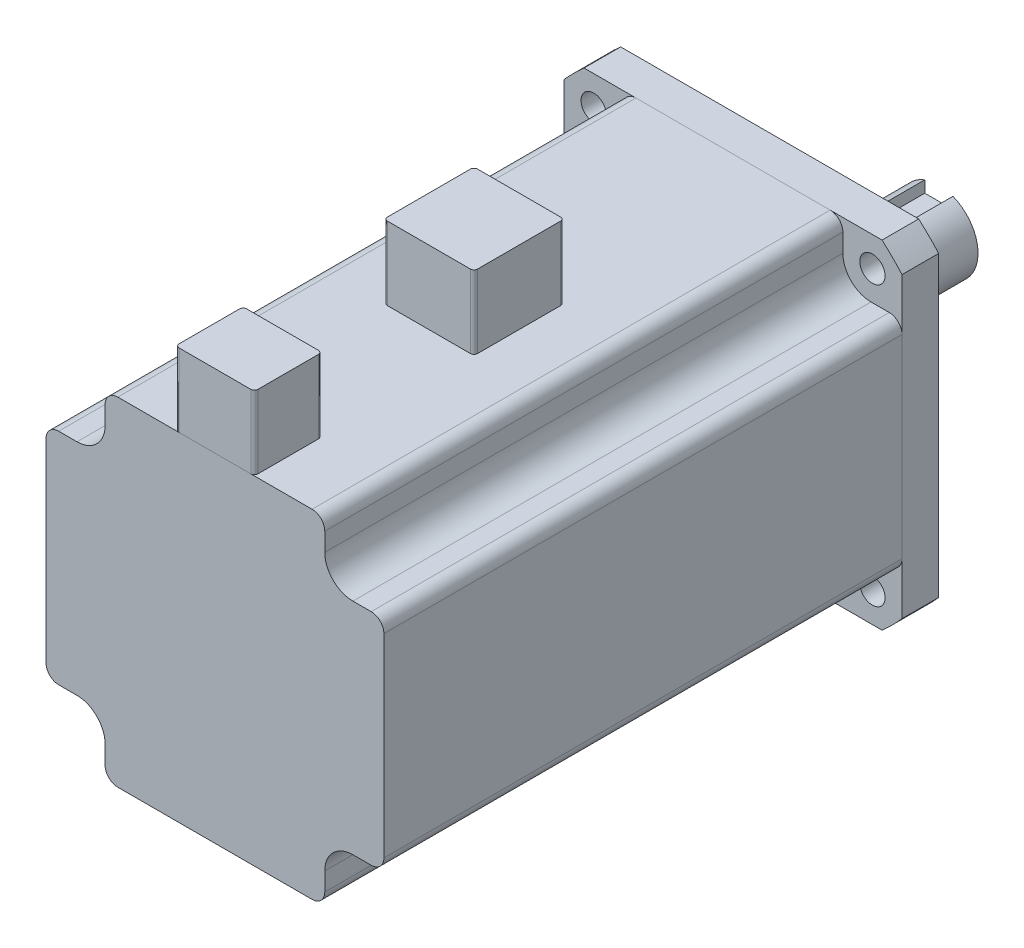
SolidWorks part; units mm, degrees
ref_plane "前视基准面" through (0, 0, 0) normal (0, 0, 1) x (1, 0, 0)
ref_plane "上视基准面" through (0, 0, 0) normal (0, 1, 0) x (1, 0, 0)
ref_plane "右视基准面" through (0, 0, 0) normal (1, 0, 0) x (0, 0, -1)
sketch "草图1" plane through (0, 0, 0) normal (0, 0, 1) x (1, 0, 0)
  line L1 (-59.0644, 2.8149) -> (-111.9794, 2.8149)
  line L2 (-55.5219, -0.7276) -> (-55.5219, -53.6426)
  line L3 (-59.0644, -57.1851) -> (-111.9794, -57.1851)
  line L4 (-115.5219, -0.7276) -> (-115.5219, -53.6426)
  line L5 (-57.2376, 1.0991) -> (-113.8062, -55.4694) construction
  line L6 (-57.2376, -55.4694) -> (-113.8062, 1.0991) construction
  circle A0 centre (-110.2706, -2.4364) radius 2.25
  circle A1 centre (-60.7732, -2.4364) radius 2.25
  circle A2 centre (-60.7732, -51.9339) radius 2.25
  circle A3 centre (-110.2706, -51.9339) radius 2.25
  arc A4 (-115.5219, -53.6426) -> (-111.9794, -57.1851) centre (-85.5219, -27.1851) ccw
  arc A5 (-111.9794, 2.8149) -> (-115.5219, -0.7276) centre (-85.5219, -27.1851) ccw
  arc A6 (-55.5219, -0.7276) -> (-59.0644, 2.8149) centre (-85.5219, -27.1851) ccw
  arc A7 (-59.0644, -57.1851) -> (-55.5219, -53.6426) centre (-85.5219, -27.1851) ccw
  point P0 (-85.5219, -27.1851)
  dimension "D3" = 4.5
  dimension "D4" = 35
  dimension "D6" = 80
  dimension "D5" = 4
extrude "凸台-拉伸1" add sketch "草图1" along normal blind 6.5
sketch "草图2" plane through (0, 0, 0) normal (0, 0, -1) x (-1, 0, 0)
  circle A0 centre (85.5219, -27.1851) radius 25
  dimension "D1" = 50
extrude "凸台-拉伸2" add sketch "草图2" along normal blind 3
sketch "草图3" plane through (0, 0, -3) normal (0, 0, -1) x (-1, 0, 0)
  line L2 (87.9764, -20.6296) -> (87.9764, -22.6851)
  line L3 (87.9764, -22.6851) -> (82.9764, -22.6851)
  line L4 (82.9764, -20.6643) -> (82.9764, -22.6851)
  arc A0 (82.9764, -20.6643) -> (87.9764, -20.6296) centre (85.5219, -27.1851) ccw
  point P3 (85.5219, -20.1851)
  dimension "D1" = 14
  dimension "D2" = 5
  dimension "D3" = 2.5
extrude "凸台-拉伸3" add sketch "草图3" along normal blind 27
sketch "草图4" plane through (0, 0, 6.5) normal (0, 0, 1) x (1, 0, 0)
  line L0 (-115.5219, -0.7276) -> (-115.5219, -53.6426) construction
  line L1 (-68.2762, 2.8149) -> (-102.7676, 2.8149)
  line L2 (-55.5219, -9.9394) -> (-55.5219, -44.4309)
  line L3 (-68.2762, -57.1851) -> (-102.7676, -57.1851)
  line L4 (-115.5219, -9.9394) -> (-115.5219, -44.4309)
  line L7 (-111.9794, -57.1851) -> (-59.0644, -57.1851) construction
  line L8 (-66.0219, 0.5606) -> (-66.0219, -2.6851)
  line L9 (-105.0219, 0.5606) -> (-105.0219, -2.6851)
  line L10 (-113.2676, -7.6851) -> (-110.0219, -7.6851)
  line L11 (-113.2676, -46.6851) -> (-110.0219, -46.6851)
  line L12 (-61.0219, -7.6851) -> (-57.7762, -7.6851)
  line L13 (-105.0219, -51.6851) -> (-105.0219, -54.9309)
  line L15 (-61.0219, -46.6851) -> (-57.7762, -46.6851)
  line L16 (-66.0219, -51.6851) -> (-66.0219, -54.9309)
  arc A0 (-61.0219, -46.6851) -> (-66.0219, -51.6851) centre (-61.0219, -51.6851) ccw
  arc A1 (-61.0219, -7.6851) -> (-66.0219, -2.6851) centre (-61.0219, -2.6851) cw
  arc A2 (-110.0219, -7.6851) -> (-105.0219, -2.6851) centre (-110.0219, -2.6851) ccw
  arc A3 (-105.0219, -51.6851) -> (-110.0219, -46.6851) centre (-110.0219, -51.6851) ccw
  arc A4 (-113.2676, -7.6851) -> (-115.5219, -9.9394) centre (-113.2676, -9.9394) ccw
  arc A5 (-105.0219, 0.5606) -> (-102.7676, 2.8149) centre (-102.7676, 0.5606) cw
  arc A6 (-66.0219, 0.5606) -> (-68.2762, 2.8149) centre (-68.2762, 0.5606) ccw
  arc A7 (-55.5219, -9.9394) -> (-57.7762, -7.6851) centre (-57.7762, -9.9394) ccw
  arc A8 (-55.5219, -44.4309) -> (-57.7762, -46.6851) centre (-57.7762, -44.4309) cw
  arc A9 (-68.2762, -57.1851) -> (-66.0219, -54.9309) centre (-68.2762, -54.9309) ccw
  arc A10 (-102.7676, -57.1851) -> (-105.0219, -54.9309) centre (-102.7676, -54.9309) cw
  arc A11 (-113.2676, -46.6851) -> (-115.5219, -44.4309) centre (-113.2676, -44.4309) cw
  point P0 (-85.5219, -27.1851)
  point P3 (-66.0219, -46.6851)
  dimension "D5" = 5
  dimension "D6" = 2.2543
  dimension "D1" = 10.5
  dimension "D2" = 10.5
  dimension "D3" = 10.5
  dimension "D4" = 10.5
extrude "凸台-拉伸4" add sketch "草图4" along normal blind 92 separate body
sketch "草图5" plane through (0, 2.8149, 0) normal (0, 1, 0) x (1, 0, 0)
  line L0 (-85.5219, -98.5) -> (-85.5219, -6.5) construction
  line L1 (-68.2762, -98.5) -> (-102.7676, -98.5) construction
  line L2 (-68.2762, -6.5) -> (-102.7676, -6.5) construction
  line L4 (-79.1604, -86.5) -> (-91.8834, -86.5)
  line L5 (-78.5219, -87.1385) -> (-78.5219, -97.8615)
  line L6 (-79.1604, -98.5) -> (-91.8834, -98.5)
  line L7 (-92.5219, -87.1385) -> (-92.5219, -97.8615)
  line L8 (-78.5219, -86.5) -> (-92.5219, -98.5) construction
  line L9 (-78.5219, -98.5) -> (-92.5219, -86.5) construction
  line L10 (-78.1604, -44.5) -> (-92.8834, -44.5)
  line L11 (-77.5219, -45.1385) -> (-77.5219, -59.8615)
  line L12 (-78.1604, -60.5) -> (-92.8834, -60.5)
  line L13 (-93.5219, -45.1385) -> (-93.5219, -59.8615)
  line L14 (-77.5219, -44.5) -> (-93.5219, -60.5) construction
  line L15 (-77.5219, -60.5) -> (-93.5219, -44.5) construction
  arc A0 (-91.8834, -98.5) -> (-92.5219, -97.8615) centre (-91.8834, -97.8615) cw
  arc A1 (-78.5219, -97.8615) -> (-79.1604, -98.5) centre (-79.1604, -97.8615) cw
  arc A2 (-79.1604, -86.5) -> (-78.5219, -87.1385) centre (-79.1604, -87.1385) cw
  arc A3 (-91.8834, -86.5) -> (-92.5219, -87.1385) centre (-91.8834, -87.1385) ccw
  arc A4 (-92.8834, -60.5) -> (-93.5219, -59.8615) centre (-92.8834, -59.8615) cw
  arc A5 (-77.5219, -59.8615) -> (-78.1604, -60.5) centre (-78.1604, -59.8615) cw
  arc A6 (-78.1604, -44.5) -> (-77.5219, -45.1385) centre (-78.1604, -45.1385) cw
  arc A7 (-92.8834, -44.5) -> (-93.5219, -45.1385) centre (-92.8834, -45.1385) ccw
  point P6 (-85.5219, -92.5)
  point P11 (-85.5219, -52.5)
  dimension "D5" = 0.6385
  dimension "D1" = 16
  dimension "D2" = 16
  dimension "D3" = 14
  dimension "D4" = 12
extrude "凸台-拉伸5" add sketch "草图5" along normal blind 13 separate body
